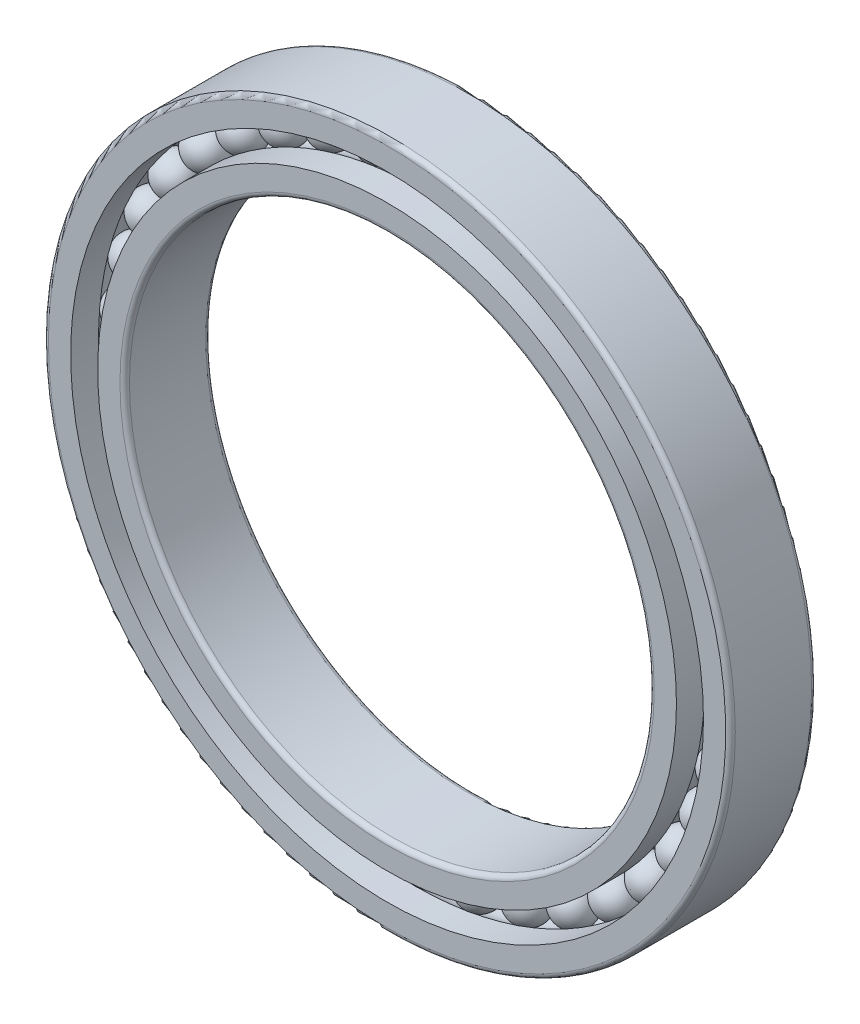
SolidWorks part; units mm, degrees
ref_plane "Front Plane" through (0, 0, 0) normal (0, 0, 1) x (1, 0, 0)
ref_plane "Top Plane" through (0, 0, 0) normal (0, 1, 0) x (1, 0, 0)
ref_plane "Right Plane" through (0, 0, 0) normal (1, 0, 0) x (0, 0, -1)
sketch "BaseSke" plane through (0, 0, 0) normal (1, 0, 0) x (0, 0, -1)
  line L0 (-47.2296, 0) -> (24.6132, 0) construction
  line L1 (-47.2296, 31.75) -> (24.6132, 31.75) construction
  line L2 (0, 129.5214) -> (0, -86.3012) construction
  line L3 (0, 33.875) -> (0, 29.625)
  line L4 (-4.5, 36) -> (4.5, 36) construction
  line L5 (-4.5, 27.5) -> (4.5, 27.5) construction
  arc A0 (0, 33.875) -> (0, 29.625) centre (0, 31.75) ccw
  dimension "Ball_diameter" = 4.25
  dimension "D1" = 31.75
  dimension "Bearing_Thickness" = 9
  dimension "Bearing_Outside_Diameter" = 72
  dimension "Bearing_Inside_Diameter" = 55
revolve "Ball" add sketch "BaseSke" angle 360 about L3
sketch "OuterRaceSke" plane through (0, 0, 0) normal (1, 0, 0) x (0, 0, -1)
  line L0 (0, 0) -> (0, 87.5396) construction
  line L1 (-4.5, 36) -> (4.5, 36)
  line L2 (-4.5, 36) -> (-4.5, 33.1667)
  line L3 (-4.5, 33.1667) -> (-1.5704, 33.1667)
  line L4 (4.5, 36) -> (4.5, 33.1667)
  line L5 (-50.3916, 0) -> (55.2197, 0) construction
  line L6 (-47.2296, 31.75) -> (24.6132, 31.75) construction
  line L7 (1.5704, 33.1667) -> (4.5, 33.1667)
  arc A0 (1.5704, 33.1667) -> (-1.5704, 33.1667) centre (0, 31.75) ccw
  dimension "D4" = 4.23
  dimension "D2" = 66.3333
revolve "OuterRace" add sketch "OuterRaceSke" angle 360 about L5
sketch "InnerRaceSke" plane through (0, 0, 0) normal (1, 0, 0) x (0, 0, -1)
  line L0 (-70.8626, 0) -> (113.5527, 0) construction
  line L1 (0, 58.441) -> (0, -70.8113) construction
  line L2 (-4.5, 27.5) -> (4.5, 27.5)
  line L3 (-4.5, 27.5) -> (-4.5, 30.3333)
  line L4 (-4.5, 30.3333) -> (-1.5704, 30.3333)
  line L5 (4.5, 27.5) -> (4.5, 30.3333)
  line L6 (0, 129.5214) -> (0, -86.3012) construction
  line L7 (1.5704, 30.3333) -> (4.5, 30.3333)
  arc A0 (-1.5704, 30.3333) -> (1.5704, 30.3333) centre (0, 31.75) ccw
  arc A1 (0, 33.875) -> (0, 29.625) centre (0, 31.75) ccw construction
  dimension "D2" = 4.23
  dimension "D1" = 60.6667
revolve "InnerRace" add sketch "InnerRaceSke" angle 360 about L0
fillet "Fillet1" radius 0.5 4 edges at (27.5, 0, -4.5) (27.5, 0, 4.5) (36, 0, -4.5) (36, 0, 4.5)
pattern_circular "CirPatternBall" count 38 over 360 about axis through (0, 0, 0) along (0, 0, 1) of "Ball"
sketch "SimplifiedSke" plane through (0, 0, 0) normal (1, 0, 0) x (0, 0, -1)
  line L0 (37.5911, 0) -> (-37.5911, 0) construction
  circle A0 centre (0, 31.75) radius 2.125
  arc A1 (0, 33.875) -> (0, 29.625) centre (0, 31.75) ccw construction
revolve "Simplified" [suppressed] add sketch "SimplifiedSke" angle 360 about L0
equation "\"D1@BaseSke\" =  (\"Bearing_Outside_Diameter@BaseSke\"  +  \"Bearing_Inside_Diameter@BaseSke\"  )  / 4"
equation "\"Ball_diameter@BaseSke\" =  ( \"Bearing_Outside_Diameter@BaseSke\" - \"Bearing_Inside_Diameter@BaseSke\" ) / 4 "
equation "\"D2@OuterRaceSke\" = \"Bearing_Outside_Diameter@BaseSke\" -  ( \"Bearing_Outside_Diameter@BaseSke\" - \"Bearing_Inside_Diameter@BaseSke\" )  / 3"
equation "\"D4@OuterRaceSke\" = (  \"Bearing_Outside_Diameter@BaseSke\" - \"Bearing_Inside_Diameter@BaseSke\" ) / 4 -0.02"
equation "\"D1@InnerRaceSke\" = \"Bearing_Inside_Diameter@BaseSke\" +  ( \"Bearing_Outside_Diameter@BaseSke\" - \"Bearing_Inside_Diameter@BaseSke\" )  / 3"
equation "\"D2@InnerRaceSke\" = \"D4@OuterRaceSke\""
equation "\"D1@CirPatternBall\" = int( \"D1@BaseSke\"* pi  * 2 / \"Ball_diameter@BaseSke\"/1.2 ) -1"
